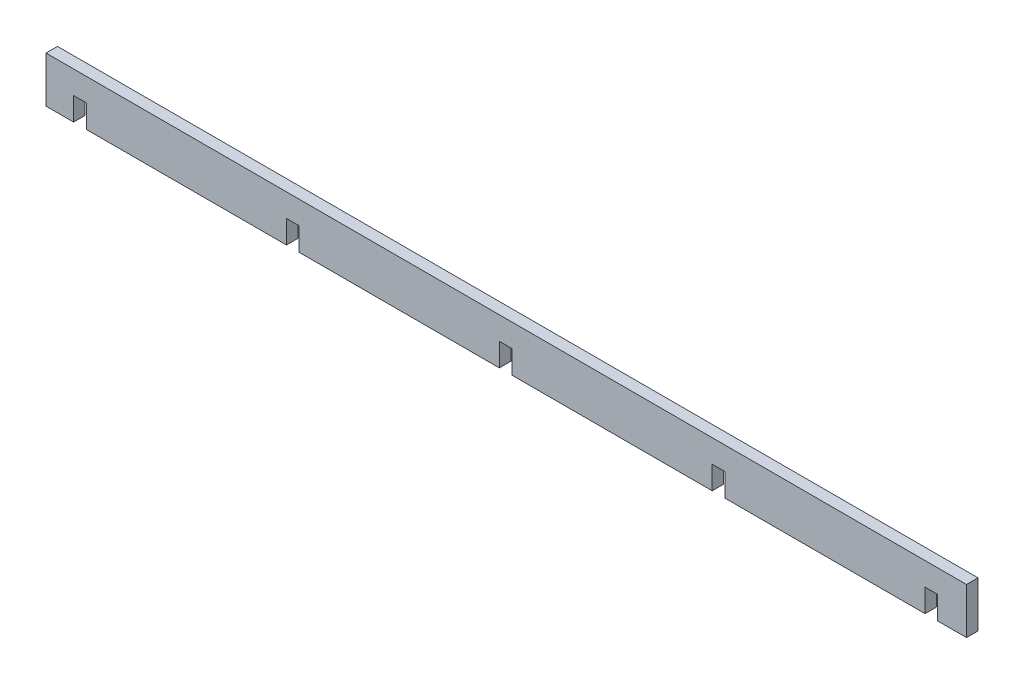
SolidWorks part; units mm, degrees
ref_plane "Plan de face" through (0, 0, 0) normal (0, 0, 1) x (1, 0, 0)
ref_plane "Plan de dessus" through (0, 0, 0) normal (0, 1, 0) x (1, 0, 0)
ref_plane "Plan de droite" through (0, 0, 0) normal (1, 0, 0) x (0, 0, -1)
sketch "Esquisse1" plane through (0, 0, 0) normal (0, 0, 1) x (1, 0, 0)
  line L1 (0, 0) -> (1600, 0)
  line L2 (0, 0) -> (0, 80)
  line L3 (0, 80) -> (1600, 80)
  line L4 (1600, 0) -> (1600, 80)
  dimension "D1" = 80
  dimension "D2" = 1600
extrude "Boss.-Extru.1" add sketch "Esquisse1" along normal mid plane 20
sketch "Esquisse3" plane through (0, 0, 0) normal (0, 0, 1) x (1, 0, 0)
  line L0 (0, 0) -> (1600, 0) construction
  line L1 (48, 0) -> (70, 0)
  line L2 (48, 0) -> (48, 40)
  line L3 (48, 40) -> (70, 40)
  line L4 (70, 0) -> (70, 40)
  line L6 (418, 40) -> (440, 40)
  line L7 (440, 0) -> (440, 40)
  line L8 (418, 0) -> (418, 40)
  line L9 (418, 0) -> (440, 0)
  line L10 (788, 40) -> (810, 40)
  line L11 (810, 0) -> (810, 40)
  line L12 (788, 0) -> (788, 40)
  line L13 (788, 0) -> (810, 0)
  line L14 (1158, 40) -> (1180, 40)
  line L15 (1180, 0) -> (1180, 40)
  line L16 (1158, 0) -> (1158, 40)
  line L17 (1158, 0) -> (1180, 0)
  line L18 (1528, 40) -> (1550, 40)
  line L19 (1550, 0) -> (1550, 40)
  line L20 (1528, 0) -> (1528, 40)
  line L21 (1528, 0) -> (1550, 0)
  line L23 (1600, 0) -> (1600, 80) construction
  line L24 (0, 80) -> (0, 0) construction
  dimension "D1" = 22
  dimension "D2" = 40
  dimension "D3" = 50
  dimension "D5" = 348
  dimension "D6" = 48
  dimension "D7" = 348
  dimension "D8" = 348
  dimension "D9" = 348
  dimension "D4" = 5
extrude "Enlèv. mat.-Extru.1" cut sketch "Esquisse3" against normal up to next and the other way up to next
